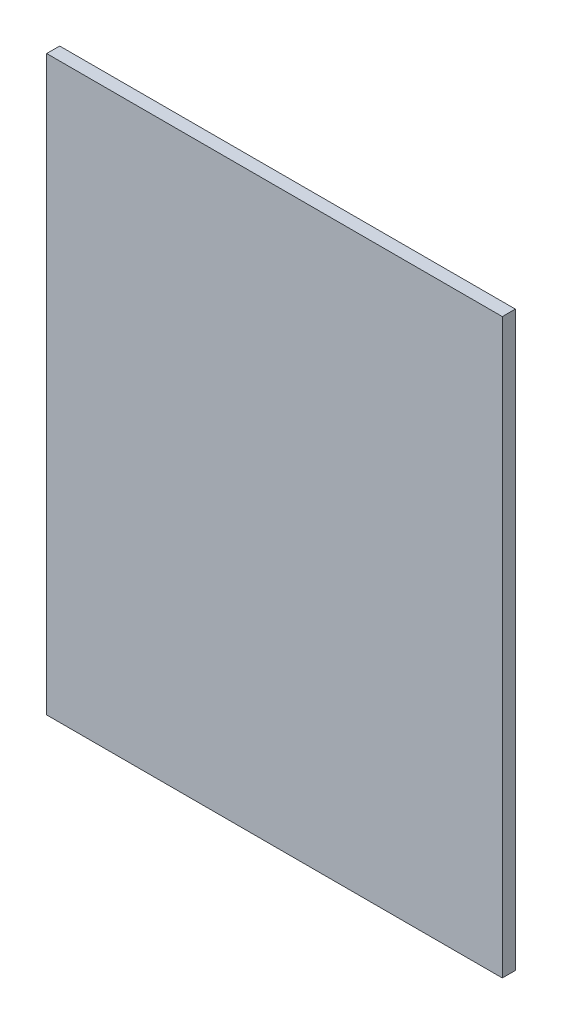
SolidWorks part; units mm, degrees
ref_plane "Front Plane" through (0, 0, 0) normal (0, 0, 1) x (1, 0, 0)
ref_plane "Top Plane" through (0, 0, 0) normal (0, 1, 0) x (1, 0, 0)
ref_plane "Right Plane" through (0, 0, 0) normal (1, 0, 0) x (0, 0, -1)
sketch "Sketch1" plane through (0, 0, 0) normal (0, 0, 1) x (1, 0, 0)
  line L1 (-175, 220) -> (175, 220)
  line L2 (-175, 220) -> (-175, -220)
  line L3 (-175, -220) -> (175, -220)
  line L4 (175, 220) -> (175, -220)
  line L5 (-175, 220) -> (175, -220) construction
  line L6 (-175, -220) -> (175, 220) construction
  point P0 (0, 0)
  dimension "D1" = 440
  dimension "D2" = 350
extrude "Boss-Extrude1" add sketch "Sketch1" along normal mid plane 10
